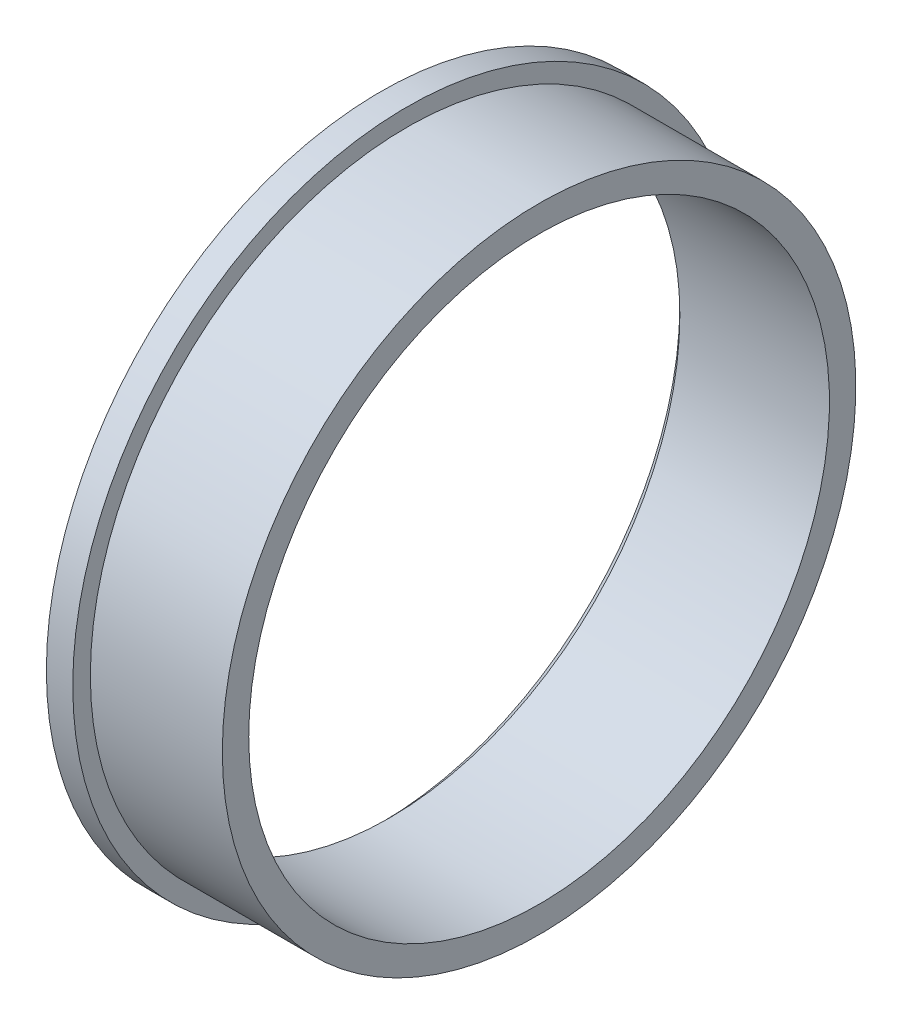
SolidWorks part; units mm, degrees
ref_plane "Plan de face" through (0, 0, 0) normal (0, 0, 1) x (1, 0, 0)
ref_plane "Plan de dessus" through (0, 0, 0) normal (0, 1, 0) x (1, 0, 0)
ref_plane "Plan de droite" through (0, 0, 0) normal (1, 0, 0) x (0, 0, -1)
sketch "Esquisse1" plane through (0, 0, 0) normal (0, 0, 1) x (1, 0, 0)
  line L0 (-16.5728, 0) -> (19.4974, 0) construction
  line L1 (0, 19) -> (0, 16.5)
  line L2 (0, 16.5) -> (9, 16.5)
  line L3 (9, 16.5) -> (9, 18)
  line L4 (9, 18) -> (1.5, 18)
  line L5 (1.5, 18) -> (1.5, 19)
  line L6 (1.5, 19) -> (0, 19)
  dimension "D1" = 1.5
  dimension "D2" = 9
  dimension "D3" = 16.5
  dimension "D4" = 18
  dimension "D5" = 19
revolve "Révolution1" add sketch "Esquisse1" angle 360 about L0
chamfer "Chanfrein1" distance 0.5 angle 45 1 edges at (0, 0, 16.5)
